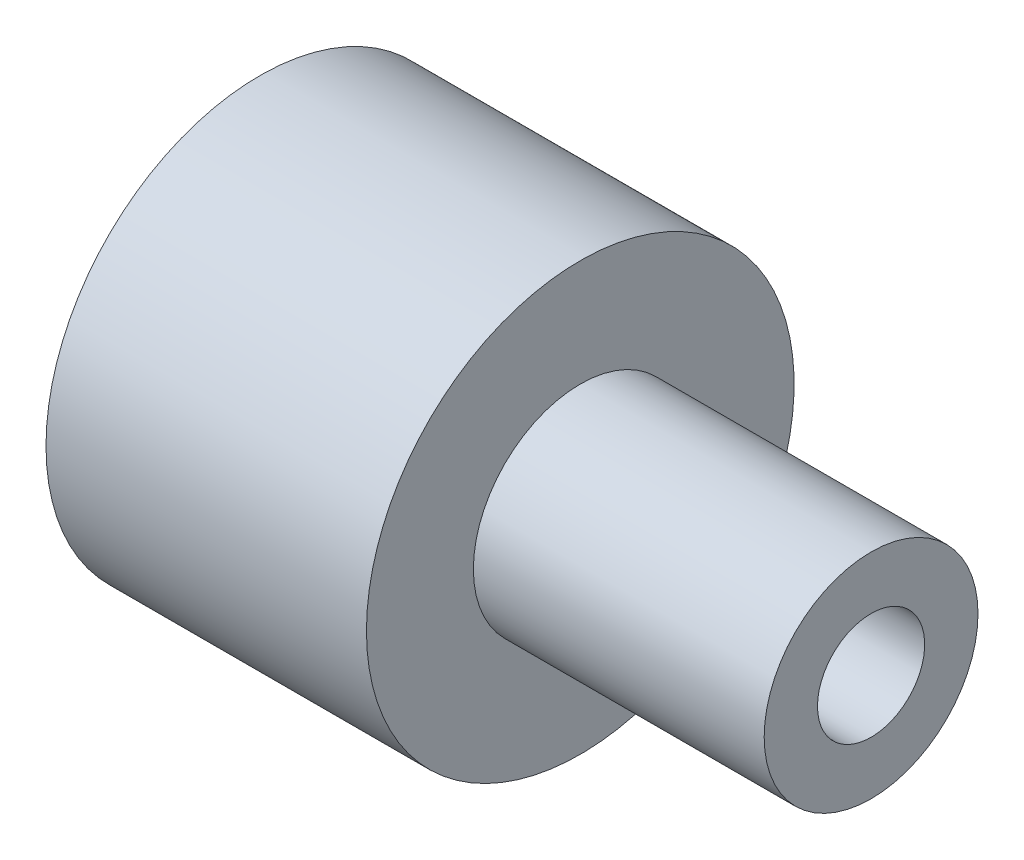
SolidWorks part; units mm, degrees
ref_plane "Front Plane" through (0, 0, 0) normal (0, 0, 1) x (1, 0, 0)
ref_plane "Top Plane" through (0, 0, 0) normal (0, 1, 0) x (1, 0, 0)
ref_plane "Right Plane" through (0, 0, 0) normal (1, 0, 0) x (0, 0, -1)
sketch "Sketch1" plane through (0, 0, 0) normal (0, 0, 1) x (1, 0, 0)
  line L0 (0, 0) -> (11.448, 0) construction
  line L1 (0, 3.9624) -> (0, 9.525)
  line L2 (0, 9.525) -> (14.2748, 9.525)
  line L3 (14.2748, 9.525) -> (14.2748, 4.7625)
  line L4 (14.2748, 4.7625) -> (27.2288, 4.7625)
  line L5 (27.2288, 4.7625) -> (27.2288, 2.3876)
  line L6 (27.2288, 2.3876) -> (13.561, 2.3876)
  line L7 (13.561, 2.3876) -> (12.192, 3.9624)
  line L8 (12.192, 3.9624) -> (0, 3.9624)
  dimension "D1" = 7.9248
  dimension "D2" = 12.192
  dimension "D3" = 49
  dimension "D4" = 14.2748
  dimension "D5" = 9.525
  dimension "D6" = 19.05
  dimension "D7" = 12.954
  dimension "D8" = 4.7752
sketch "Sketch2" plane through (0, 0, 0) normal (0, 0, 1) x (1, 0, 0)
  line L0 (12.192, 3.9624) -> (0, 3.9624) construction
  line L1 (0, 3.9624) -> (0, 9.525) construction
  line L2 (0, 9.525) -> (14.2748, 9.525) construction
  line L3 (14.2748, 9.525) -> (14.2748, 4.7625) construction
  line L4 (14.2748, 4.7625) -> (27.2288, 4.7625) construction
  line L5 (27.2288, 4.7625) -> (27.2288, 2.3876) construction
  line L6 (27.2288, 2.3876) -> (13.561, 2.3876) construction
  line L7 (13.561, 2.3876) -> (12.192, 3.9624) construction
  line L8 (12.192, 3.9624) -> (0, 3.9624)
  line L9 (0, 3.9624) -> (0, 9.525)
  line L10 (0, 9.525) -> (14.2748, 9.525)
  line L11 (14.2748, 9.525) -> (14.2748, 4.7625)
  line L12 (14.2748, 4.7625) -> (27.2288, 4.7625)
  line L13 (27.2288, 4.7625) -> (27.2288, 2.3876)
  line L14 (27.2288, 2.3876) -> (13.561, 2.3876)
  line L15 (13.561, 2.3876) -> (12.192, 3.9624)
revolve "Revolve1" add sketch "Sketch2" angle 360 about L0
